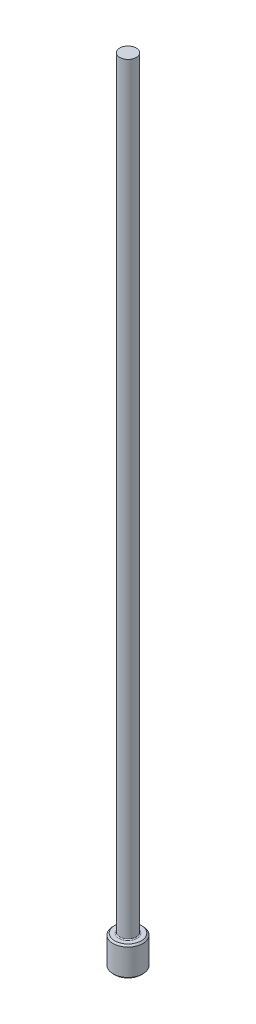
SolidWorks part; units mm, degrees
ref_plane "Front Plane" through (0, 0, 0) normal (0, 0, 1) x (1, 0, 0)
ref_plane "Top Plane" through (0, 0, 0) normal (0, 1, 0) x (1, 0, 0)
ref_plane "Right Plane" through (0, 0, 0) normal (1, 0, 0) x (0, 0, -1)
other "Configuration Table"
sketch "Sketch1" plane through (0, 0, 0) normal (0, 0, 1) x (1, 0, 0)
  line L0 (0, 259.9588) -> (0, -15.1925) construction
  line L1 (0, 0) -> (-1.1938, 0)
  line L2 (-1.1938, 0) -> (-1.1938, 2.3622)
  line L3 (-1.1938, 2.3622) -> (-0.6604, 2.3622)
  line L4 (-0.6604, 2.3622) -> (-0.6604, 63.5)
  line L5 (-0.6604, 63.5) -> (0, 63.5)
  line L6 (0, 63.5) -> (0, 0)
  dimension "L" = 63.5
  dimension "H" = 2.3876
  dimension "T" = 2.3622
  dimension "D" = 1.3208
revolve "Revolve1" add sketch "Sketch1" angle 360 about L0
chamfer "Chamfer1" distance 0.127 angle 45 2 edges at (0, 2.3622, 1.1938) (0, 0, 1.1938)
fillet "Fillet1" radius 0.0762 1 edges at (0, 2.3622, 0.6604)
